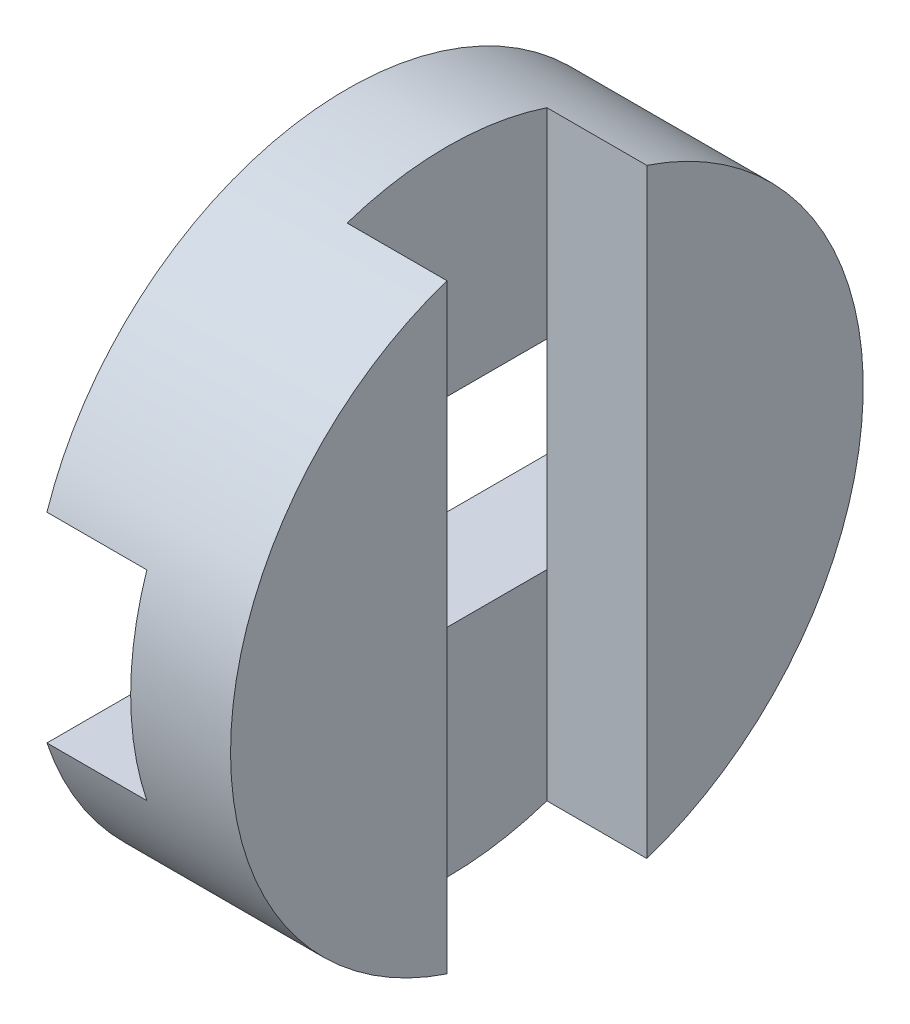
SolidWorks part; units mm, degrees
ref_plane "Plan1" through (0, 0, 0) normal (0, 0, 1) x (1, 0, 0)
ref_plane "Plan2" through (0, 0, 0) normal (0, 1, 0) x (1, 0, 0)
ref_plane "Plan3" through (0, 0, 0) normal (1, 0, 0) x (0, 0, -1)
sketch "Esquisse1" plane through (0, 0, 0) normal (0, 0, 1) x (1, 0, 0)
  line L0 (0, 0) -> (17.6901, 0) construction
  line L2 (0, 0) -> (6, 0)
  line L3 (0, 0) -> (0, 9.5)
  line L4 (0, 9.5) -> (6, 9.5)
  line L5 (6, 0) -> (6, 9.5)
  dimension "D1" = 9.5
  dimension "D2" = 6
revolve "Base-Révolution" add sketch "Esquisse1" angle 360 about L0
sketch "Esquisse2" plane through (0, 0, 0) normal (0, 0, 1) x (1, 0, 0)
  line L0 (-1.7667, 0) -> (3.4211, 0) construction
  line L1 (0, 3) -> (3, 3)
  line L2 (0, 3) -> (0, -3)
  line L3 (0, -3) -> (3, -3)
  line L4 (3, 3) -> (3, -3)
  line L5 (0, 0) -> (17.6901, 0) construction
  line L6 (0, 9.5) -> (0, -9.5) construction
  dimension "D1" = 3
  dimension "D2" = 6
extrude "Enlèv. mat.-Extru.1" cut sketch "Esquisse2" against normal mid plane 20
sketch "Esquisse3" plane through (0, 0, 0) normal (0, 1, 0) x (1, 0, 0)
  line L0 (0, 0) -> (7.1604, 0) construction
  line L1 (6, 3) -> (3, 3)
  line L2 (6, 3) -> (6, -3)
  line L3 (6, -3) -> (3, -3)
  line L4 (3, 3) -> (3, -3)
  line L5 (0, 0) -> (17.6901, 0) construction
  line L6 (6, -9.5) -> (6, 9.5) construction
  dimension "D1" = 3
  dimension "D2" = 6
extrude "Enlèv. mat.-Extru.2" cut sketch "Esquisse3" against normal mid plane 20
sketch "Esq_WRNL_Compact001" plane through (0, 0, 0) normal (0, 0, 1) x (1, 0, 0)
  line L0 (-1, -10.5) -> (-1, 10.5)
  line L1 (7, -10.5) -> (7, 10.5)
  line L2 (-1, -10.5) -> (7, -10.5)
  line L3 (-1, 10.5) -> (7, 10.5)
